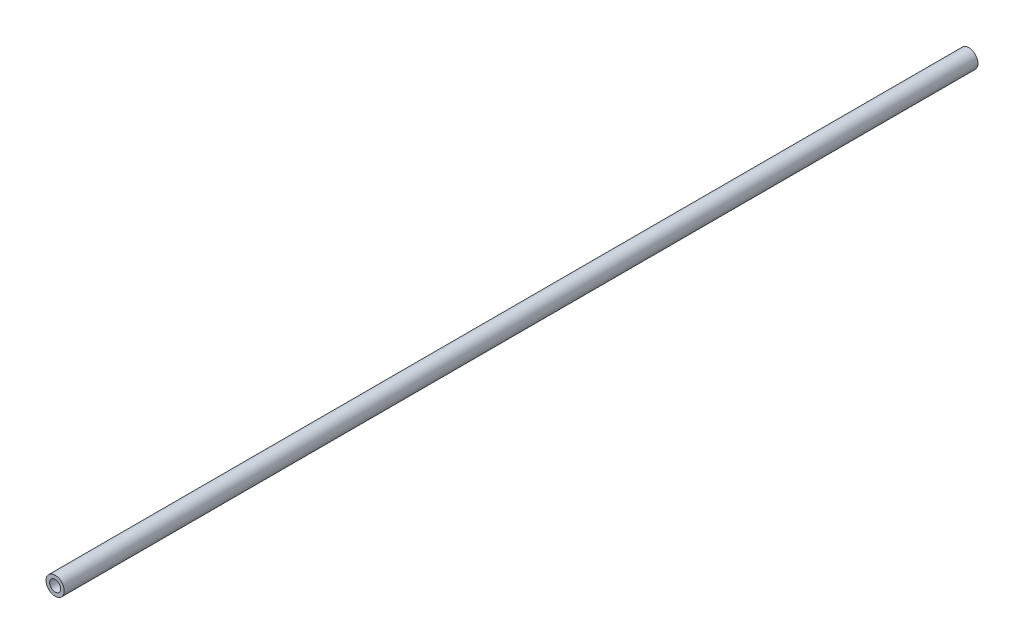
SolidWorks part; units mm, degrees
ref_plane "Front Plane" through (0, 0, 0) normal (0, 0, 1) x (1, 0, 0)
ref_plane "Top Plane" through (0, 0, 0) normal (0, 1, 0) x (1, 0, 0)
ref_plane "Right Plane" through (0, 0, 0) normal (1, 0, 0) x (0, 0, -1)
sketch "Sketch1" plane through (0, 0, 0) normal (1, 0, 0) x (0, 0, -1)
  line L0 (0, 0) -> (-1000, 0)
sketch "Sketch2" plane through (0, 0, 0) normal (0, 0, 1) x (1, 0, 0)
  circle A0 centre (0, 0) radius 10
  dimension "D1" = 20
sweep "Sweep-Thin1" add profiles "Sketch2" path "Sketch1" parameters "D1"=4
